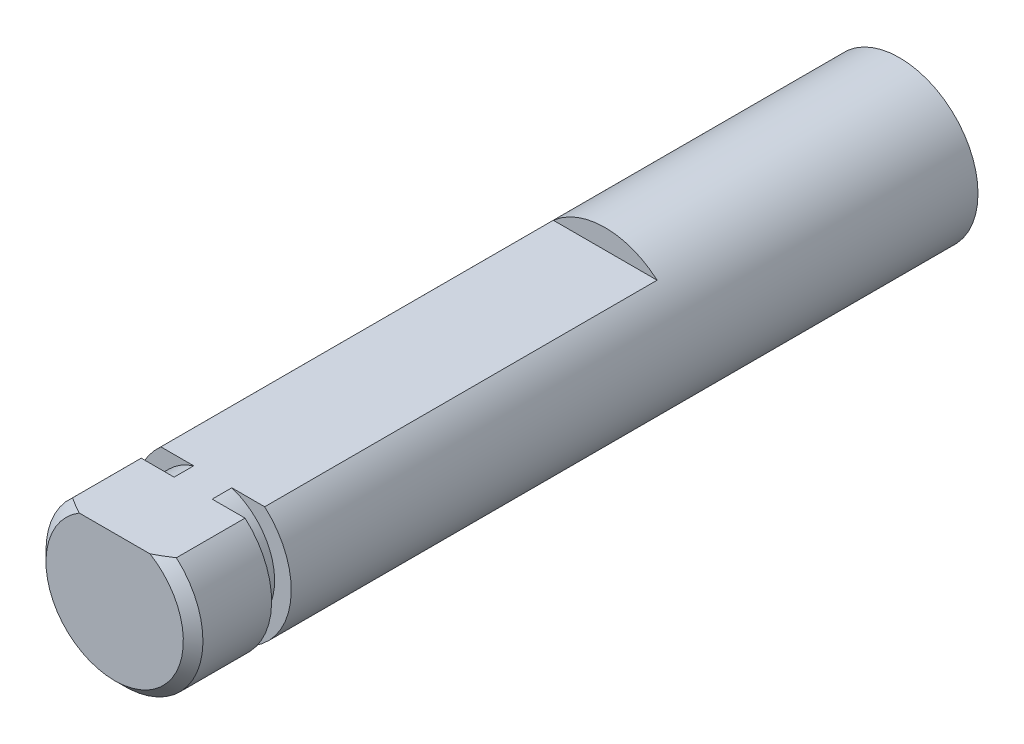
SolidWorks part; units mm, degrees
ref_plane "Plan de face" through (0, 0, 0) normal (0, 0, 1) x (1, 0, 0)
ref_plane "Plan de dessus" through (0, 0, 0) normal (0, 1, 0) x (1, 0, 0)
ref_plane "Plan de droite" through (0, 0, 0) normal (1, 0, 0) x (0, 0, -1)
sketch "Esquisse1" plane through (0, 0, 0) normal (0, 0, 1) x (1, 0, 0)
  circle A0 centre (0, 0) radius 4
  dimension "D1" = 8
extrude "Extrusion1" add sketch "Esquisse1" along normal blind 40
sketch "Esquisse2" plane through (0, 0, 40) normal (0, 0, 1) x (1, 0, 0)
  line L1 (-2.8876, 4) -> (2.6742, 4)
  line L2 (-2.8876, 4) -> (-2.8876, 3)
  line L3 (-2.8876, 3) -> (2.6742, 3)
  line L4 (2.6742, 4) -> (2.6742, 3)
  dimension "D1" = 3
  dimension "D2" = 1
extrude "Enlèv. mat.-Extru.1" cut sketch "Esquisse2" against normal blind 25
sketch "Esquisse3" plane through (0, 0, 0) normal (1, 0, 0) x (0, 0, -1)
  line L0 (-40, 3) -> (-40, -4) construction
  line L1 (-36, -4.9963) -> (-35, -4.9963)
  line L2 (-36, -4.9963) -> (-36, -3.153)
  line L3 (-36, -3.153) -> (-35, -3.153)
  line L4 (-35, -4.9963) -> (-35, -3.153)
  dimension "D1" = 5
  dimension "D2" = 1
ref_axis "Axe1" through (0, 0, 40) along (0, 0, -1)
revolve "Enlèvement de matière-Révolution1" cut sketch "Esquisse3" angle 360 about axis through (0, 0, 40) along (0, 0, -1)
chamfer "Chanfrein1" distance 0.5 angle 45 1 edges at (0, -4, 40)
